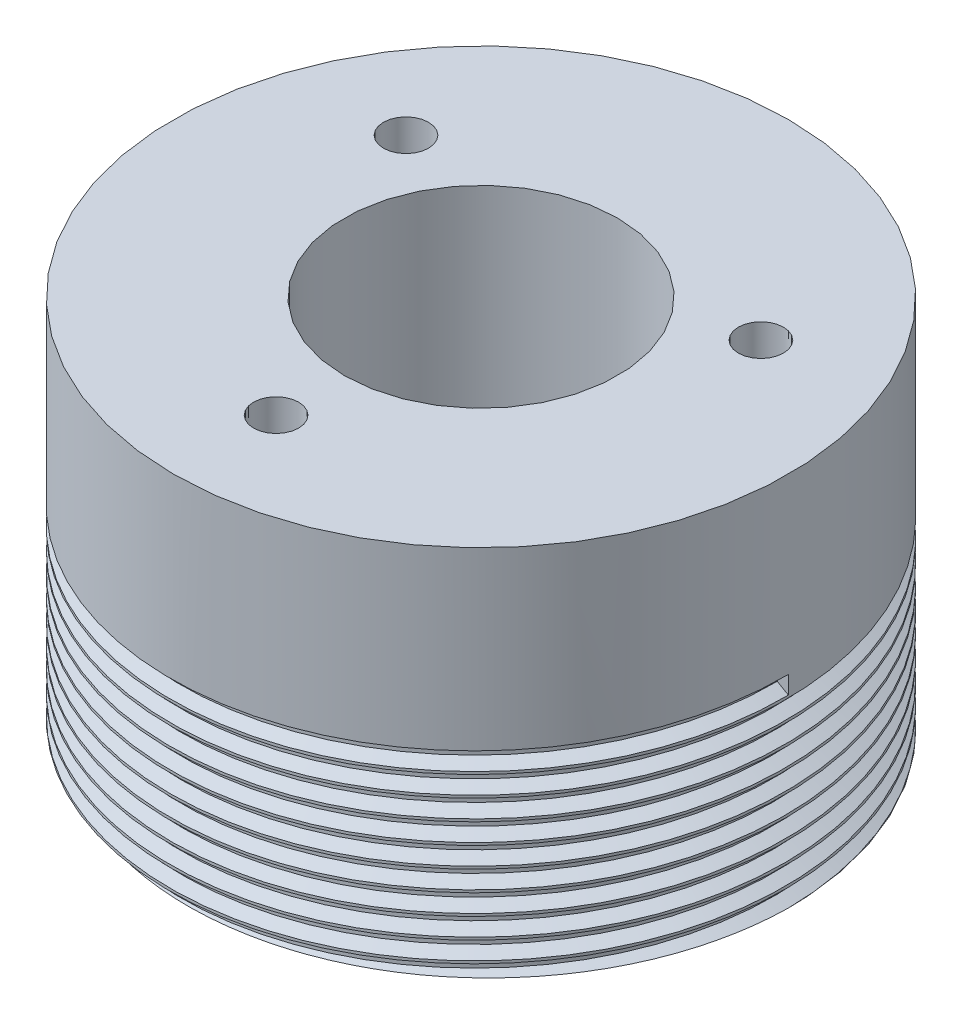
SolidWorks part; units mm, degrees
ref_plane "Front Plane" through (0, 0, 0) normal (0, 0, 1) x (1, 0, 0)
ref_plane "Top Plane" through (0, 0, 0) normal (0, 1, 0) x (1, 0, 0)
ref_plane "Right Plane" through (0, 0, 0) normal (1, 0, 0) x (0, 0, -1)
sketch "Sketch1" plane through (0, 0, 0) normal (0, 1, 0) x (1, 0, 0)
  circle A0 centre (0, 0) radius 22.5
  dimension "D1" = 45
extrude "Boss-Extrude1" add sketch "Sketch1" along normal blind 27.5
hole_wizard "M4x0.7 Tapped Hole1" positions "Sketch9" profile "Sketch10" tap size "M4x0.7" standard "ANSI Metric"
sketch "Sketch9" plane through (0, 27.5, 0) normal (0, 1, 0) x (1, 0, 0)
  line L0 (0, 0) -> (0, -15) construction
  point P0 (0, -15)
  dimension "D1" = 15
sketch "Sketch10" plane through (0, 27.5, 15) normal (1, 0, 0) x (0, 0, 1)
  line L0 (0, 0) -> (0, 11.0914)
  line L1 (0, 11.0914) -> (1.65, 10.1)
  line L2 (1.65, 10.1) -> (1.65, 0)
  line L5 (1.65, 0) -> (0, 0)
  line L10 (0, 11.0914) -> (-1.65, 10.1) construction
  line L11 (0, -6.35) -> (0, 107.95) construction
  dimension "Tap Drill Dia." = 3.3
  dimension "Tap Drill Depth" = 10.1
  dimension "Drill Angle" = 118
thread "Thread1" pitch 1.5 start angle 0, offset 1.5, length 15, pitch 1.5, diameter 45
ref_plane "Plane1" through (22.5, -1.5, 0) normal (0, 0, 1) x (1, 0, 0)
sketch "Thread Profile1" plane through (22.5, -1.5, 0) normal (0, 0, 1) x (1, 0, 0)
  line L0 (0, 0) -> (0, 1.5) construction
  line L11 (0, 0) -> (0, 1.3125)
  line L12 (0, 1.3125) -> (-0.8119, 0.8437)
  line L13 (-0.8119, 0.8437) -> (-0.8119, 0.4687)
  line L15 (-0.8119, 0.4687) -> (0, 0)
  line L17 (-0.8119, 0.6562) -> (0, 0.6562) construction
  point P2 (0, 0)
  dimension "Pitch" = 1.5
  dimension "Profile_Angle" = 60
  dimension "Profile_Land" = 0.375
  dimension "Profile_Height" = 0.8119
pattern_circular "CirPattern1" count 3 over 360 about axis through (0, 0, 0) along (0, 1, 0) of "M4x0.7 Tapped Hole1"
sketch "Sketch13" plane through (0, 27.5, 0) normal (0, 1, 0) x (1, 0, 0)
  circle A0 centre (0, 0) radius 10
  circle A3 centre (0, 0) radius 22.5 construction
  dimension "D1" = 20
extrude "Cut-Extrude1" cut sketch "Sketch13" against normal blind 15
hole_wizard "CBORE for M6 SHCS1" positions "Sketch14" profile "Sketch15" counterbore size "M6" standard "ANSI Metric"
sketch "Sketch14" plane through (0, 12.5, 0) normal (0, 1, 0) x (1, 0, 0)
  point P0 (0, 0)
sketch "Sketch15" plane through (0, 12.5, 0) normal (1, 0, 0) x (0, 0, 1)
  line L0 (0, 0) -> (0, 13.0574)
  line L1 (0, 13.0574) -> (3.3, 13.0574)
  line L3 (3.3, 13.0574) -> (3.3, 6)
  line L4 (3.3, 6) -> (5.5, 6)
  line L5 (5.5, 6) -> (5.5, 0)
  line L7 (5.5, 0) -> (0, 0)
  line L11 (0, -6.35) -> (0, 107.95) construction
  dimension "Thru Hole Dia." = 6.6
  dimension "Thru Hole Depth" = 13.0574
  dimension "C'Bore Dia." = 11
  dimension "C'Bore Depth" = 6
sketch "Sketch16" plane through (0, 0, 0) normal (0, -1, 0) x (-1, 0, 0)
  line L0 (17.5, 0) -> (0, 0) construction
  circle A0 centre (17.5, 0) radius 2.5
  dimension "D1" = 5
  dimension "D2" = 17.5
extrude "Cut-Extrude2" cut sketch "Sketch16" against normal blind 3
pattern_circular "CirPattern2" count 3 over 360 about axis through (0, 0, 0) along (0, 1, 0) of "Cut-Extrude2"
sketch "Sketch17" plane through (0, 0, 0) normal (0, -1, 0) x (-1, 0, 0)
  circle A0 centre (0, 0) radius 12.5
  dimension "D1" = 25
extrude "Cut-Extrude3" cut sketch "Sketch17" against normal blind 5
sketch "Sketch18" plane through (0, 12.5, 0) normal (0, 1, 0) x (1, 0, 0)
  line L1 (3.2187, 5.575) -> (-3.2187, 5.575)
  line L2 (-3.2187, 5.575) -> (-6.4375, 0)
  line L3 (-6.4375, 0) -> (-3.2187, -5.575)
  line L4 (-3.2187, -5.575) -> (3.2187, -5.575)
  line L5 (3.2187, -5.575) -> (6.4375, 0)
  line L6 (6.4375, 0) -> (3.2187, 5.575)
  circle A0 centre (0, 0) radius 5.575 construction
  dimension "D1" = 11.15
extrude "Cut-Extrude4" cut sketch "Sketch18" against normal blind 5.25
